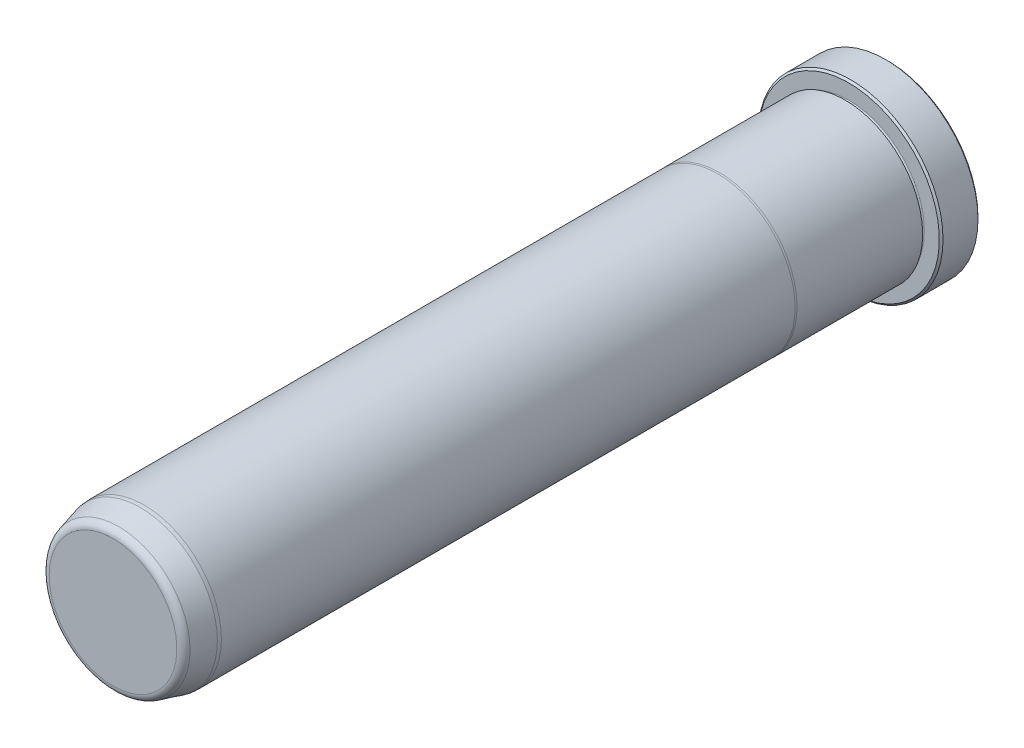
SolidWorks part; units mm, degrees
ref_plane "Front Plane" through (0, 0, 0) normal (0, 0, 1) x (1, 0, 0)
ref_plane "Top Plane" through (0, 0, 0) normal (0, 1, 0) x (1, 0, 0)
ref_plane "Right Plane" through (0, 0, 0) normal (1, 0, 0) x (0, 0, -1)
sketch "Sketch1" plane through (0, 0, 0) normal (1, 0, 0) x (0, 0, -1)
  line L0 (0, 0) -> (0, 18.923)
  line L1 (0, 18.923) -> (-7.9248, 18.923)
  line L2 (-7.9248, 18.923) -> (-7.9248, 15.4813)
  line L3 (-4.7498, 15.1003) -> (-5.5118, 15.1003) construction
  line L4 (-8.6868, 15.4813) -> (-8.6868, 15.8877)
  line L5 (-8.6868, 15.8877) -> (-34.4348, 15.8877)
  line L6 (-34.4348, 15.8877) -> (-34.798, 15.8623)
  line L7 (-34.798, 15.8623) -> (-152.4, 15.8623)
  line L9 (-158.75, 14.2983) -> (-158.75, 0)
  line L10 (-158.75, 0) -> (0, 0)
  line L11 (0, 0) -> (13.6287, 0) construction
  line L12 (-152.4, 15.8623) -> (-153.162, 15.7956)
  line L13 (-153.162, 15.7956) -> (-158.75, 14.2983)
  arc A0 (-8.6868, 15.4813) -> (-7.9248, 15.4813) centre (-8.3058, 15.4813) ccw
  dimension "D14" = 0.762
  dimension "D1" = 7.9248
  dimension "D2" = 0.762
  dimension "D3" = 37.846
  dimension "D4" = 31.7754
  dimension "D5" = 34.798
  dimension "D6" = 158.75
  dimension "D7" = 0.7874
  dimension "D8" = 4
  dimension "D9" = 31.7246
  dimension "D10" = 5
  dimension "D11" = 15
  dimension "D12" = 0.762
  dimension "D13" = 6.35
revolve "Revolve1" add sketch "Sketch1" angle 360 about L11
fillet "Fillet6" radius 1.5875 1 edges at (14.2983, 0, 158.75)
chamfer "Chamfer1" distance 0.381 angle 45 2 edges at (18.923, 0, 0) (18.923, 0, 7.9248)
